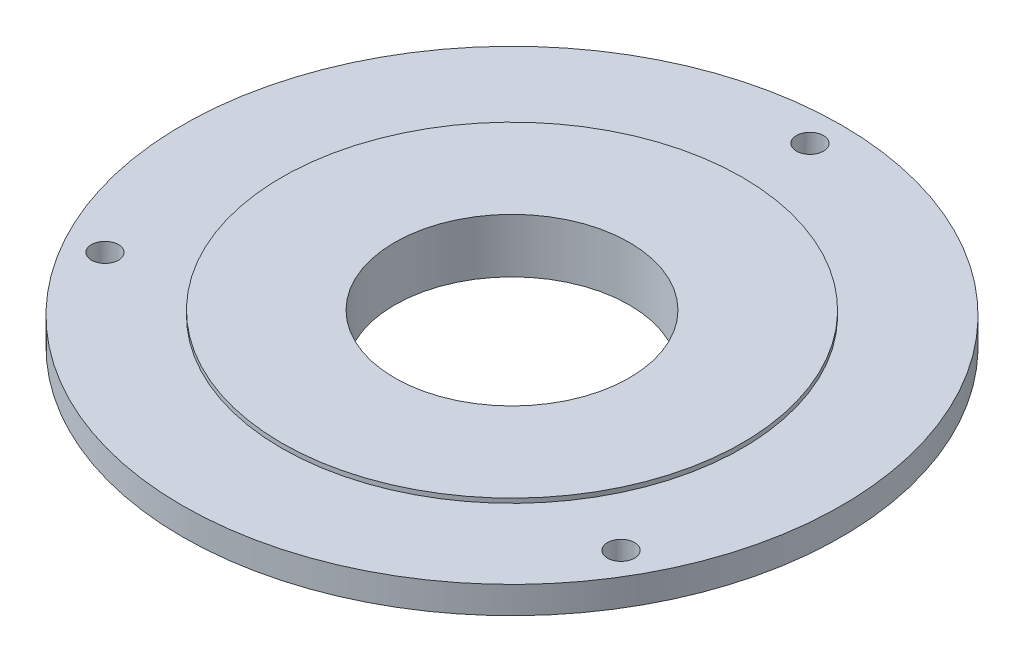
SolidWorks part; units mm, degrees
ref_plane "Piano frontale" through (0, 0, 0) normal (0, 0, 1) x (1, 0, 0)
ref_plane "Piano superiore" through (0, 0, 0) normal (0, 1, 0) x (1, 0, 0)
ref_plane "Piano destro" through (0, 0, 0) normal (1, 0, 0) x (0, 0, -1)
sketch "Schizzo1" plane through (0, 0, 0) normal (0, 0, 1) x (1, 0, 0)
  line L0 (0, 0) -> (0, 68.8521) construction
  line L4 (36.5, 37.3859) -> (36.5, 34.3859)
  line L10 (14.25, 34.3859) -> (36.5, 34.3859)
  line L15 (13, 37.8859) -> (25.5, 37.8859)
  line L16 (25.5, 37.8859) -> (25.5, 37.3859)
  line L17 (13, 31.8859) -> (13, 37.8859)
  line L18 (25.5, 37.3859) -> (36.5, 37.3859)
  line L19 (13, 31.8859) -> (14.25, 31.8859)
  line L20 (14.25, 31.8859) -> (14.25, 34.3859)
  dimension "D1" = 25.5
  dimension "D2" = 36.5
  dimension "D3" = 2.5
  dimension "D4" = 0.5
  dimension "D5" = 13
  dimension "D6" = 3
  dimension "D7" = 14.25
revolve "Rivoluzione1" add sketch "Schizzo1" angle 360 about L0
sketch "Schizzo2" plane through (0, 37.3859, 0) normal (0, 1, 0) x (1, 0, 0)
  circle A0 centre (0, 33) radius 1.5
  circle A1 centre (28.5788, -16.5) radius 1.5
  circle A2 centre (-28.5788, -16.5) radius 1.5
  point P10 (0, 0)
  dimension "D1" = 3
  dimension "D2" = 33
  dimension "D3" = 3
extrude "Taglio-Estrusione1" cut sketch "Schizzo2" against normal through all
